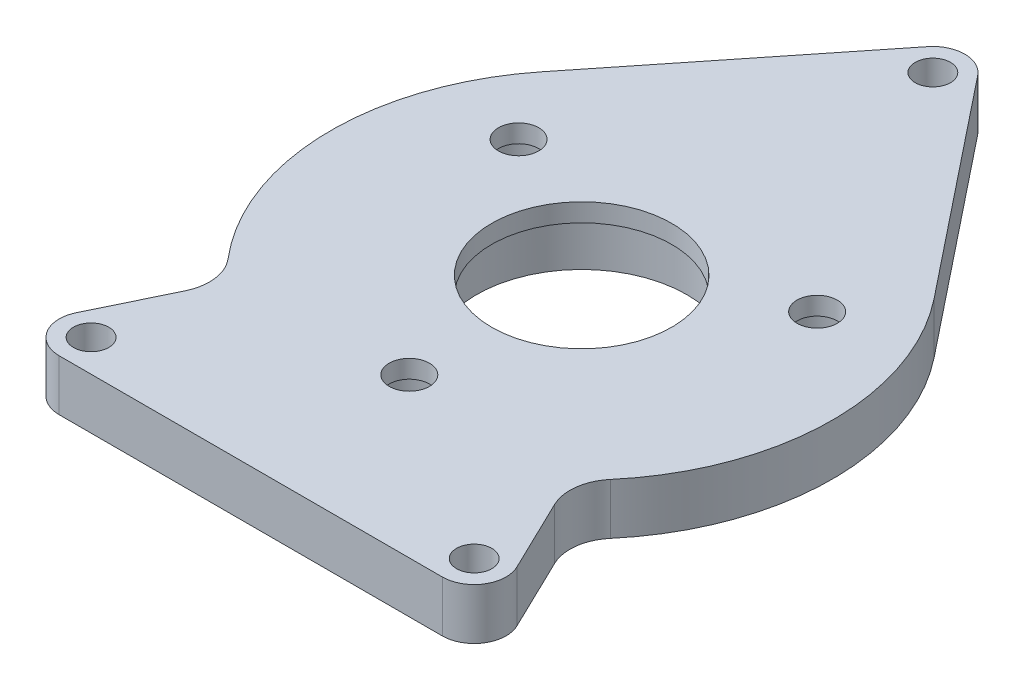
SolidWorks part; units mm, degrees
ref_plane "Front Plane" through (0, 0, 0) normal (0, 0, 1) x (1, 0, 0)
ref_plane "Top Plane" through (0, 0, 0) normal (0, 1, 0) x (1, 0, 0)
ref_plane "Right Plane" through (0, 0, 0) normal (1, 0, 0) x (0, 0, -1)
sketch "Sketch1" plane through (0, 0, 0) normal (0, 1, 0) x (1, 0, 0)
  line L3 (0, -59.0094) -> (0, 53.34) construction
  line L8 (-25.7364, -29.4897) -> (-30.672, -39.7012)
  line L10 (-26.67, -41.6356) -> (26.67, -41.6356) construction
  line L12 (-3.4756, 51.6659) -> (-27.3086, 21.7714)
  line L13 (3.4756, 51.6659) -> (27.3086, 21.7714)
  line L32 (-26.67, -46.0806) -> (26.67, -46.0806)
  line L33 (30.672, -39.7012) -> (25.7364, -29.4897)
  arc A0 (-27.3086, 21.7714) -> (-26.6146, -22.6146) centre (0, 0) ccw
  circle A1 centre (0, 0) radius 24 construction
  arc A2 (26.6146, -22.6146) -> (27.3086, 21.7714) centre (0, 0) ccw
  arc A3 (3.4756, 51.6659) -> (-3.4756, 51.6659) centre (0, 48.895) ccw
  arc A5 (25.7364, -29.4897) -> (26.6146, -22.6146) centre (31.4536, -26.7264) cw
  arc A6 (-25.7364, -29.4897) -> (-26.6146, -22.6146) centre (-31.4536, -26.7264) ccw
  circle A11 centre (0, 0) radius 12.5381
  arc A19 (-30.672, -39.7012) -> (-26.67, -46.0806) centre (-26.67, -41.6356) ccw
  arc A20 (26.67, -46.0806) -> (30.672, -39.7012) centre (26.67, -41.6356) ccw
  point P4 (0, 0)
  point P28 (23.8255, -25.5363)
  point P35 (0, 0)
  point P36 (0, 0)
  dimension "D1" = 69.85
  dimension "D2" = 48
  dimension "D4" = 6.35
  dimension "D5" = 25.0762
  dimension "D9" = 4.445
  dimension "D11" = 4.445
  dimension "D6" = 41.6356
  dimension "D7" = 48.895
  dimension "D8" = 26.67
  dimension "D3" = 46.0806
  dimension "D10" = 31.4536
extrude "Boss-Extrude1" add sketch "Sketch1" along normal blind 7.112
sketch "Sketch9" plane through (0, 0, 0) normal (0, -1, 0) x (1, 0, 0)
  circle A0 centre (0, 0) radius 12.5381
  circle A1 centre (0, 0) radius 19.0373
  circle A2 centre (0, 0) radius 12.5381 construction
  dimension "D1" = 38.0746
extrude "Boss-Extrude2" add sketch "Sketch9" along normal blind 2.54
hole_wizard "CBORE for #10 Button Head Cap Screw1" positions "Sketch5" profile "Sketch6" counterbore size "#10" standard "ANSI Inch"
sketch "Sketch5" plane through (0, -2.54, 0) normal (0, -1, 0) x (-1, 0, 0)
  circle A0 centre (0, -24) radius 2.1 construction
  circle A1 centre (-20.7846, 12) radius 2.1 construction
  circle A2 centre (20.7846, 12) radius 2.1 construction
  point P0 (-20.7846, 12)
  point P2 (0, -24)
  point P4 (20.7846, 12)
sketch "Sketch6" plane through (20.7846, -2.54, -12) normal (1, 0, 0) x (0, 0, -1)
  line L0 (0, 0) -> (0, 9.652)
  line L1 (0, 9.652) -> (2.8067, 9.652)
  line L3 (2.8067, 9.652) -> (2.8067, 7.1374)
  line L4 (2.8067, 7.1374) -> (4.9606, 7.1374)
  line L5 (4.9606, 7.1374) -> (4.9606, 0)
  line L7 (4.9606, 0) -> (0, 0)
  line L11 (0, -6.35) -> (0, 107.95) construction
  dimension "Thru Hole Dia." = 5.6134
  dimension "Thru Hole Depth" = 9.652
  dimension "C'Bore Dia." = 9.9212
  dimension "C'Bore Depth" = 7.1374
hole_wizard "#10 (0.1935) Diameter Hole1" positions "Sketch7" profile "Sketch8" hole size "#10" standard "ANSI Inch"
sketch "Sketch7" plane through (0, 7.112, 0) normal (0, 1, 0) x (1, 0, 0)
  circle A3 centre (26.67, -41.6356) radius 1.7272 construction
  circle A4 centre (-26.67, -41.6356) radius 1.7272 construction
  circle A5 centre (0, 48.895) radius 1.7272 construction
  point P0 (26.67, -41.6356)
  point P2 (-26.67, -41.6356)
  point P4 (0, 48.895)
sketch "Sketch8" plane through (26.67, 7.112, 41.6356) normal (1, 0, 0) x (0, 0, 1)
  line L0 (0, 0) -> (0, 9.652)
  line L1 (0, 9.652) -> (2.4574, 9.652)
  line L2 (2.4574, 9.652) -> (2.4574, 0)
  line L5 (2.4574, 0) -> (0, 0)
  line L11 (0, -6.35) -> (0, 107.95) construction
  dimension "Thru Hole Dia." = 4.9149
  dimension "Thru Hole Depth" = 9.652
sketch "Sketch10" plane through (0, -2.54, 0) normal (0, -1, 0) x (1, 0, 0)
  circle A0 centre (0, 0) radius 14.6431
  circle A1 centre (0, 0) radius 12.5381 construction
  dimension "D1" = 29.2862
extrude "Cut-Extrude1" cut sketch "Sketch10" against normal offset from surface (7.112 mm away) 2.54
